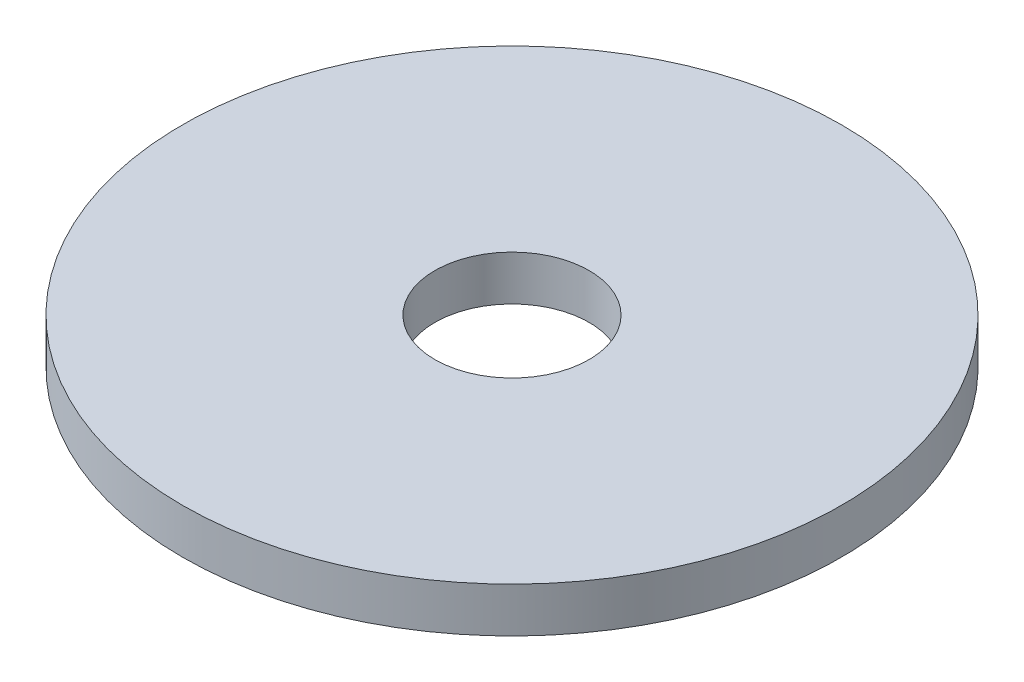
SolidWorks part; units mm, degrees
ref_plane "Plan de face" through (0, 0, 0) normal (0, 0, 1) x (1, 0, 0)
ref_plane "Plan de dessus" through (0, 0, 0) normal (0, 1, 0) x (1, 0, 0)
ref_plane "Plan de droite" through (0, 0, 0) normal (1, 0, 0) x (0, 0, -1)
ref_plane "Plan1" through (0, 0, 0) normal (0, 0, -1) x (-1, 0, 0)
sketch "Esquisse1" plane through (0, 0, 0) normal (0, 0, -1) x (-1, 0, 0)
  line L0 (-5.15, 3) -> (-22, 3)
  line L1 (-22, 3) -> (-22, 0)
  line L2 (-22, 0) -> (-5.15, 0)
  line L3 (-5.15, 0) -> (-5.15, 3)
  line L4 (0, 0) -> (0, 3) construction
revolve "Révolution1" add sketch "Esquisse1" angle 360 about L4
